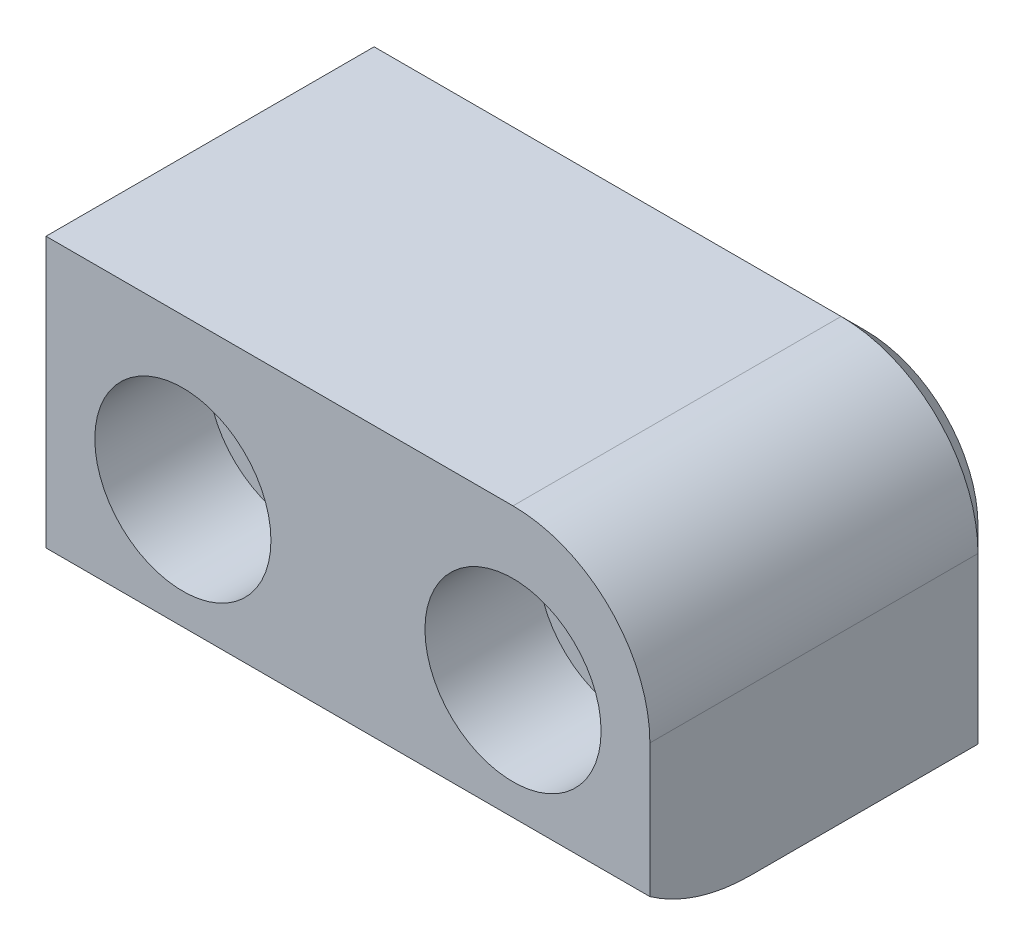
SolidWorks part; units mm, degrees
ref_plane "Front Plane" through (0, 0, 0) normal (0, 0, 1) x (1, 0, 0)
ref_plane "Top Plane" through (0, 0, 0) normal (0, 1, 0) x (1, 0, 0)
ref_plane "Right Plane" through (0, 0, 0) normal (1, 0, 0) x (0, 0, -1)
sketch "Sketch3" plane through (0, 0, 0) normal (0, 0, 1) x (1, 0, 0)
  line L0 (0, -10.4775) -> (0, 10.4775) construction
  line L1 (0, 19.05) -> (38.1, 19.05)
  line L2 (0, 19.05) -> (0, 0)
  line L3 (0, 0) -> (38.1, 0)
  line L4 (38.1, 19.05) -> (38.1, 0)
  dimension "D1" = 19.05
  dimension "D2" = 38.1
extrude "Extrude1" add sketch "Sketch3" against normal blind 22.225
fillet "Fillet1" radius 8.636 1 edges at (38.1, 19.05, -11.1125)
hole_wizard "1/4\"-20 CBORE" positions "Sketch7" profile "Sketch6" counterbore size "1/4" standard "Ansi Inch"
sketch "Sketch7" plane through (0, 0, 0) normal (0, 0, 1) x (1, 0, 0)
  line L1 (-2.0915, 9.525) -> (49997.9085, 9.525) construction
  line L2 (29.464, 19.05) -> (0, 19.05) construction
  line L3 (0, 0) -> (38.1, 0) construction
  line L4 (0, 19.05) -> (0, 0) construction
  line L5 (38.1, 0) -> (38.1, 10.414) construction
  point P0 (8.636, 9.525)
  point P1 (29.464, 9.525)
  dimension "D1" = 8.636
  dimension "D2" = 8.636
sketch "Sketch6" plane through (8.636, 9.525, 0) normal (1, 0, 0) x (0, -1, 0)
  line L0 (0, 0) -> (0, 22.225)
  line L1 (0, 22.225) -> (3.2639, 22.225)
  line L3 (3.2639, 22.225) -> (3.2639, 7.145)
  line L4 (3.2639, 7.145) -> (5.5562, 7.145)
  line L5 (5.5562, 7.145) -> (5.5562, 0)
  line L7 (5.5562, 0) -> (0, 0)
  line L11 (0, -6.35) -> (0, 107.95) construction
  dimension "Thru Hole Dia." = 6.5278
  dimension "Thru Hole Depth" = 22.225
  dimension "C'Bore Dia." = 11.1125
  dimension "C'Bore Depth" = 7.145
sketch "Sketch8" plane through (0, 0, 0) normal (-1, 0, 0) x (0, 0, 1)
  line L0 (0, 2.0168) -> (12.7, 2.0168)
  line L1 (12.7, 2.0168) -> (12.7, -10.6832)
  line L2 (-6.35, -10.6832) -> (-6.35, 0)
  line L3 (12.7, -10.6832) -> (-6.35, -10.6832)
  line L4 (-22.225, 0) -> (0, 0) construction
  line L13 (-22.225, 0) -> (0, 0) construction
  line L14 (0, 19.05) -> (0, 0) construction
  arc A0 (-6.35, 0) -> (0, 2.0168) centre (-6.35, 11.005) ccw
  arc A2 (-1.216, 0.5243) -> (0, 2.0168) centre (-1.524, 2.0168) ccw construction
  arc A3 (-6.35, 0) -> (-1.216, 0.5243) centre (-6.35, 25.4) ccw construction
  dimension "D1" = 25.4
  dimension "D2" = 1.524
  dimension "D3" = 6.35
  dimension "D4" = 12.7
  dimension "D5" = 12.7
extrude "Cut-Extrude1" cut sketch "Sketch8" against normal through all
chamfer "Chamfer1" distance 1.524 angle 45 3 edges at (14.732, 19.05, -22.225) (38.1, 5.207, -22.225) (35.5706, 16.5206, -22.225)
